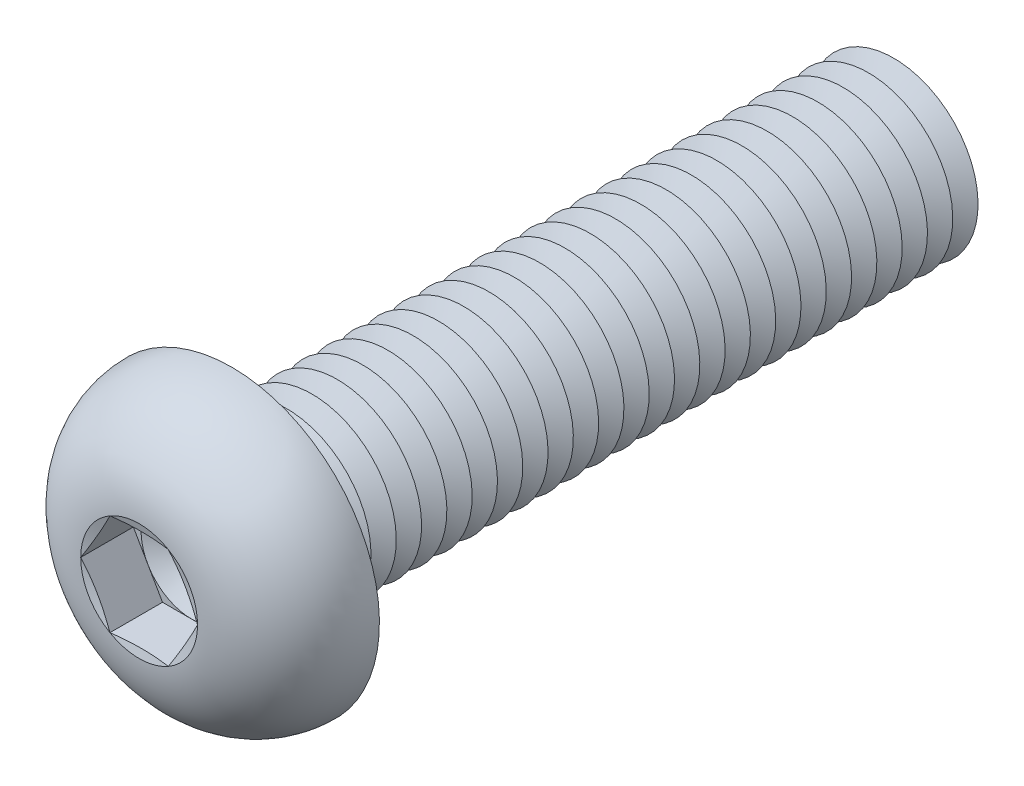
SolidWorks part; units mm, degrees
ref_plane "Front Plane" through (0, 0, 0) normal (0, 0, 1) x (1, 0, 0)
ref_plane "Top Plane" through (0, 0, 0) normal (0, 1, 0) x (1, 0, 0)
ref_plane "Right Plane" through (0, 0, 0) normal (1, 0, 0) x (0, 0, -1)
sketch "Sketch1" plane through (0, 0, 0) normal (1, 0, 0) x (0, 0, -1)
  line L0 (0, 5) -> (0, 8.75)
  line L3 (0, 5) -> (40, 5)
  line L4 (40, 5) -> (40, 0)
  line L5 (40, 0) -> (-5.5, 0) construction
  line L6 (-5.5, 0) -> (40, 0)
  line L7 (-5.5, 3.4641) -> (-5.5, 1.732) construction
  line L8 (-5.5, 1.732) -> (-5.5, 0)
  line L9 (-5.5, 3.4641) -> (-5.0359, 1.732)
  line L10 (-5.0359, 1.732) -> (-5.5, 1.732)
  line L11 (40, 0) -> (22.7481, 0) construction
  line L12 (0, 8.75) -> (-5.5, 8.75) construction
  arc A1 (0, 8.75) -> (-5.5, 3.4641) centre (0, 3.2457) ccw
  point P8 (40, 2.5)
  dimension "D1" = 17.5
  dimension "D2" = 10
  dimension "D3" = 5.5
  dimension "D4" = 6.9282
  dimension "D5" = 40
  dimension "D6" = 15
revolve "Revolve1" add sketch "Sketch1" angle 360 about L5
fillet "Fillet1" radius 0.75 1 edges at (0, 5, 0)
sketch "Sketch2" plane through (0, 0, 0) normal (1, 0, 0) x (0, 0, -1)
  line L0 (39.25, 5) -> (40.75, 5)
  line L1 (40, 5) -> (0.75, 5) construction
  line L2 (40.75, 5) -> (40, 3.701)
  line L3 (40, -5) -> (40, 5) construction
  line L4 (40, 3.701) -> (39.25, 5)
  dimension "D1" = 1.5
revolve "Cut-Revolve1" cut sketch "Sketch2" angle 360 about axis through (0, 0, -40) along (0, 0, -1)
pattern_linear "LPattern1" count 26 spacing 1.5 along (0, 0, 1) of "Cut-Revolve1"
sketch "Sketch3" plane through (0, 0, 5.5) normal (0, 0, 1) x (1, 0, 0)
  line L7 (1.732, 3) -> (-1.7321, 3)
  line L8 (-1.7321, 3) -> (-3.4641, 0)
  line L9 (-3.4641, 0) -> (-1.732, -3)
  line L10 (-1.732, -3) -> (1.732, -3)
  line L11 (1.732, -3) -> (3.4641, 0)
  line L12 (3.4641, 0) -> (1.732, 3)
  circle A0 centre (0, 0) radius 3 construction
  circle A3 centre (0, 0) radius 3.4641 construction
extrude "Cut-Extrude1" cut sketch "Sketch3" against normal blind 3.12
sketch "Sketch4" plane through (0, 0, 2.38) normal (0, 0, 1) x (1, 0, 0)
  line L1 (1.732, 3) -> (-1.7321, 3) construction
  circle A0 centre (0, 0) radius 3
extrude "Cut-Extrude2" cut sketch "Sketch4" against normal through all draft 60
